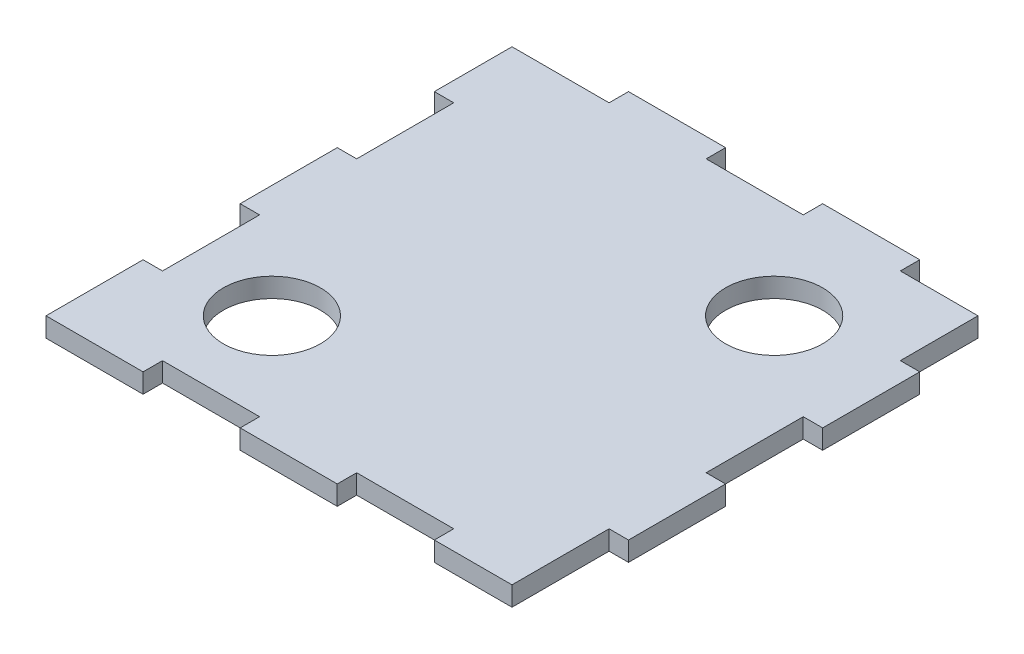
SolidWorks part; units mm, degrees
ref_plane "Front Plane" through (0, 0, 0) normal (0, 0, 1) x (1, 0, 0)
ref_plane "Top Plane" through (0, 0, 0) normal (0, 1, 0) x (1, 0, 0)
ref_plane "Right Plane" through (0, 0, 0) normal (1, 0, 0) x (0, 0, -1)
sketch "Sketch2" plane through (0, 0, 0) normal (0, 1, 0) x (1, 0, 0)
  line L1 (-50, 46) -> (-30, 46)
  line L2 (-50, 46) -> (-50, 30)
  line L3 (-50, -50) -> (-30, -50)
  line L4 (46, 46) -> (46, 30)
  line L8 (-30, 46) -> (-30, 50)
  line L9 (-30, 50) -> (-10, 50)
  line L11 (46, 30) -> (50, 30)
  line L14 (-10, 50) -> (-10, 46)
  line L15 (-10, 46) -> (10, 46)
  line L16 (10, 46) -> (10, 50)
  line L17 (10, 50) -> (30, 50)
  line L18 (30, 50) -> (30, 46)
  line L19 (30, 46) -> (46, 46)
  line L20 (-10, -50) -> (-10, -46)
  line L21 (-10, -46) -> (-30, -46)
  line L22 (-30, -46) -> (-30, -50)
  line L23 (-10, -50) -> (10, -50)
  line L24 (10, -50) -> (10, -46)
  line L25 (10, -46) -> (30, -46)
  line L26 (30, -46) -> (30, -50)
  line L27 (30, -50) -> (46, -50)
  line L29 (50, 30) -> (50, 10)
  line L30 (50, 10) -> (46, 10)
  line L31 (46, 10) -> (46, -10)
  line L32 (46, -10) -> (50, -10)
  line L33 (50, -10) -> (50, -30)
  line L34 (50, -30) -> (46, -30)
  line L35 (46, -30) -> (46, -50)
  line L36 (-50, 30) -> (-46, 30)
  line L37 (-46, 30) -> (-46, 10)
  line L38 (-46, 10) -> (-50, 10)
  line L39 (-50, 10) -> (-50, -10)
  line L40 (-50, -10) -> (-46, -10)
  line L41 (-46, -10) -> (-46, -30)
  line L42 (-46, -30) -> (-50, -30)
  line L43 (-50, -30) -> (-50, -50)
  circle A0 centre (25, 25) radius 10
  circle A1 centre (-26.7321, -26.7321) radius 10
  point P0 (0, 0)
extrude "Boss-Extrude1" add sketch "Sketch2" along normal blind 4
equation "\"Slit thick\"= 4"
equation "\"Slit wide\"= 20"
equation "\"Piece Thick\"= 4"
equation "\"Slit distance\"= 20"
equation "\"D3@Sketch2\"=\"Slit distance\""
equation "\"D4@Sketch2\"=\"Slit distance\""
equation "\"D6@Sketch2\"=\"Slit wide\""
equation "\"D8@Sketch2\"=\"Slit wide\""
equation "\"D10@Sketch2\"=\"Slit wide\""
equation "\"D12@Sketch2\"=\"Slit thick\""
equation "\"D14@Sketch2\"=\"Slit thick\""
equation "\"D15@Sketch2\"=\"Slit wide\""
equation "\"D16@Sketch2\"=\"Slit distance\""
equation "\"D17@Sketch2\"=\"Slit wide\""
equation "\"D18@Sketch2\"=\"Slit distance\""
equation "\"D20@Sketch2\"=\"Slit thick\""
equation "\"D21@Sketch2\"=\"Slit wide\""
equation "\"D22@Sketch2\"=\"Slit distance\""
equation "\"D23@Sketch2\"=\"Slit wide\""
equation "\"D24@Sketch2\"=\"Slit distance\""
equation "\"diam\"= 20"
equation "\"D25@Sketch2\"=\"diam\""
equation "\"D26@Sketch2\"=\"diam\""
equation "\"D1@Boss-Extrude1\"=\"Piece Thick\""
